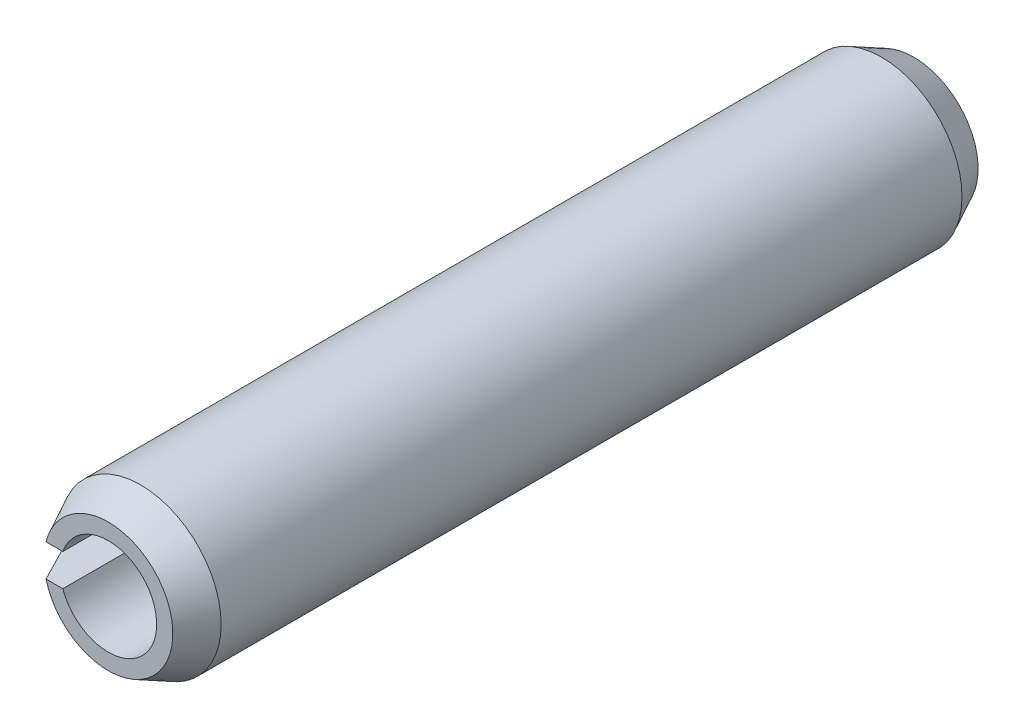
SolidWorks part; units mm, degrees
ref_plane "Plan1" through (0, 0, 0) normal (0, 0, 1) x (1, 0, 0)
ref_plane "Plan2" through (0, 0, 0) normal (0, 1, 0) x (1, 0, 0)
ref_plane "Plan3" through (0, 0, 0) normal (1, 0, 0) x (0, 0, -1)
imported_body "Goupille élastique, épaisse, de 10 x 50 - NF E 27-489"
sketch "Esquisse1" plane through (0, 0, 0) normal (0, 0, 1) x (1, 0, 0)
  line L0 (-4.899, 1) -> (-3.873, 1) construction
  line L1 (-3.873, 1) -> (-2.8284, 1)
  line L2 (-3.873, -1) -> (-4.899, -1) construction
  line L3 (-2.8284, -1) -> (-3.873, -1)
  arc A1 (-3.873, -1) -> (-3.873, 1) centre (0, 0) ccw construction
  arc A2 (-2.9047, -0.75) -> (-2.9047, 0.75) centre (0, 0) ccw
  arc A3 (-2.8284, -1) -> (-2.8284, 1) centre (0, 0) ccw
  arc A4 (-3.873, -1) -> (-3.873, 1) centre (0, 0) ccw
  dimension "D1" = 1
extrude "Boss.-Extru.2" add sketch "Esquisse1" along normal blind 50
